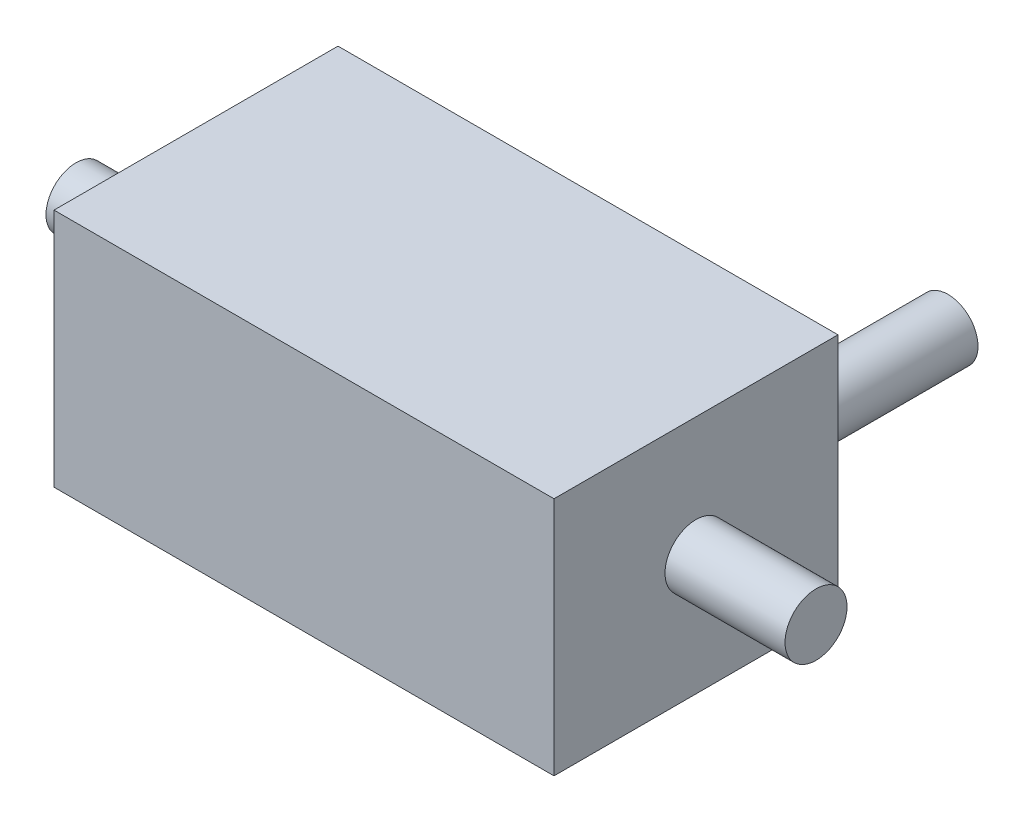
SolidWorks part; units mm, degrees
ref_plane "前视基准面" through (0, 0, 0) normal (0, 0, 1) x (1, 0, 0)
ref_plane "上视基准面" through (0, 0, 0) normal (0, 1, 0) x (1, 0, 0)
ref_plane "右视基准面" through (0, 0, 0) normal (1, 0, 0) x (0, 0, -1)
other "Configuration Table"
sketch "草图1" plane through (0, 0, 0) normal (0, 1, 0) x (1, 0, 0)
  line L1 (0, 0) -> (25, 0)
  line L2 (0, 0) -> (0, 14.2)
  line L3 (0, 14.2) -> (25, 14.2)
  line L4 (25, 0) -> (25, 14.2)
  dimension "D1" = 25
  dimension "D2" = 14.2
extrude "凸台-拉伸1" add sketch "草图1" along normal blind 12
sketch "草图2" plane through (0, 0, 0) normal (-1, 0, 0) x (0, 0, 1)
  line L0 (-14.2, 0) -> (0, 12)
  circle A0 centre (-7.1, 6) radius 1.5
extrude "凸台-拉伸2" add sketch "草图2" along normal blind 5 contours L0 A0 | L0 A0
sketch "草图3" plane through (25, 0, 0) normal (1, 0, 0) x (0, 0, -1)
  circle A0 centre (7.1, 6) radius 1.55
extrude "凸台-拉伸3" add sketch "草图3" along normal blind 5
sketch "草图7" plane through (0, 0, -14.2) normal (0, 0, -1) x (-1, 0, 0)
  circle A0 centre (-21.5, 6) radius 1.5
  point P9 (-15.8036, 8.4702)
extrude "凸台-拉伸4" add sketch "草图7" along normal blind 9
sketch "草图8" plane through (30, 0, 0) normal (1, 0, 0) x (0, 0, -1)
  circle A0 centre (7.1, 6) radius 1.55
extrude "凸台-拉伸5" add sketch "草图8" along normal blind 1
sketch "草图9" plane through (-5, 0, 0) normal (-1, 0, 0) x (0, 0, 1)
  circle A0 centre (-7.1, 6) radius 1.5
extrude "凸台-拉伸6" add sketch "草图9" along normal blind 1
